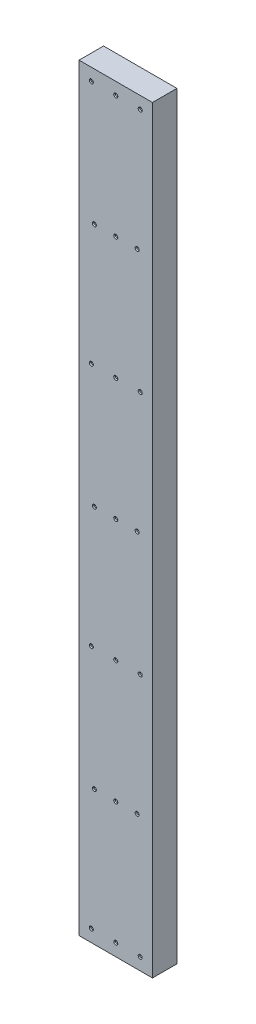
SolidWorks part; units mm, degrees
ref_plane "Front Plane" through (0, 0, 0) normal (0, 0, 1) x (1, 0, 0)
ref_plane "Top Plane" through (0, 0, 0) normal (0, 1, 0) x (1, 0, 0)
ref_plane "Right Plane" through (0, 0, 0) normal (1, 0, 0) x (0, 0, -1)
sketch "Sketch1" plane through (0, 0, 0) normal (0, 1, 0) x (1, 0, 0)
  line L1 (-76.2, 25.4) -> (76.2, 25.4)
  line L2 (-76.2, 25.4) -> (-76.2, -25.4)
  line L3 (-76.2, -25.4) -> (76.2, -25.4)
  line L4 (76.2, 25.4) -> (76.2, -25.4)
  line L5 (-76.2, 25.4) -> (76.2, -25.4) construction
  line L6 (-76.2, -25.4) -> (76.2, 25.4) construction
  point P0 (0, 0)
  dimension "D1" = 152.4
  dimension "D2" = 50.8
extrude "Boss-Extrude1" add sketch "Sketch1" along normal blind 1574.8
hole_wizard "CSK for #8 Flat Head Machine Screw (100)1" positions "Sketch3" profile "Sketch2" countersink size "#8" standard "ANSI Inch"
sketch "Sketch3" plane through (0, 0, 25.4) normal (0, 0, 1) x (1, 0, 0)
  line L0 (0, 0) -> (0, 1574.8) construction
  line L1 (-76.2, 0) -> (76.2, 0) construction
  line L2 (-76.2, 1574.8) -> (76.2, 1574.8) construction
  line L4 (-50.8, 0) -> (-50.8, 1574.8) construction
  line L6 (50.8, 1574.8) -> (50.8, 0) construction
  line L8 (-76.2, 25.4) -> (76.2, 25.4) construction
  line L9 (-76.2, 1574.8) -> (-76.2, 0) construction
  line L10 (76.2, 1574.8) -> (76.2, 0) construction
  line L12 (-76.2, 533.4) -> (76.2, 533.4) construction
  line L17 (-76.2, 1549.4) -> (76.2, 1549.4) construction
  point P0 (-50.8, 25.4)
  point P2 (0, 25.4)
  point P4 (50.8, 25.4)
  point P6 (-50.8, 1549.4)
  point P8 (0, 1549.4)
  point P10 (50.8, 1549.4)
  point P12 (-50.8, 1041.4)
  point P14 (0, 1041.4)
  point P16 (50.8, 1041.4)
  point P18 (-50.8, 533.4)
  point P20 (0, 533.4)
  point P22 (50.8, 533.4)
  dimension "D1" = 25.4
  dimension "D2" = 127
  dimension "D3" = 25.4
  dimension "D4" = 533.4
  dimension "D5" = 1041.4
  dimension "D6" = 1549.4
sketch "Sketch2" plane through (-50.8, 25.4, 25.4) normal (1, 0, 0) x (0, -1, 0)
  line L0 (0, 0) -> (0, 50.8)
  line L1 (0, 50.8) -> (2.2479, 50.8)
  line L2 (2.2479, 50.8) -> (2.2479, 1.6518)
  line L3 (2.2479, 1.6518) -> (4.2164, 0)
  line L5 (4.2164, 0) -> (0, 0)
  line L6 (-2.2479, 1.6518) -> (-4.2164, 0) construction
  line L11 (0, -6.35) -> (0, 107.95) construction
  dimension "Thru Hole Dia." = 4.4958
  dimension "Thru Hole Depth" = 50.8
  dimension "Near C'Sink Dia." = 8.4328
  dimension "Near C'Sink Angle" = 100
hole_wizard "CSK for #8 Flat Head Machine Screw (100)2" positions "Sketch5" profile "Sketch4" countersink size "#8" standard "ANSI Inch"
sketch "Sketch5" plane through (0, 0, 25.4) normal (0, 0, 1) x (1, 0, 0)
  line L0 (-76.2, 279.4) -> (76.2, 279.4) construction
  line L1 (-76.2, 1574.8) -> (-76.2, 0) construction
  line L2 (76.2, 1574.8) -> (76.2, 0) construction
  line L4 (-76.2, 787.4) -> (76.2, 787.4) construction
  line L6 (-76.2, 1295.4) -> (76.2, 1295.4) construction
  line L8 (-76.2, 0) -> (76.2, 0) construction
  point P0 (-44.45, 279.4)
  point P2 (0, 279.4)
  point P4 (44.45, 279.4)
  point P6 (-44.45, 787.4)
  point P8 (0, 787.4)
  point P10 (44.45, 787.4)
  point P12 (-44.45, 1295.4)
  point P14 (0, 1295.4)
  point P16 (44.45, 1295.4)
  dimension "D1" = 279.4
  dimension "D2" = 787.4
  dimension "D3" = 1295.4
sketch "Sketch4" plane through (-44.45, 279.4, 25.4) normal (1, 0, 0) x (0, -1, 0)
  line L0 (0, 0) -> (0, 50.8)
  line L1 (0, 50.8) -> (2.2479, 50.8)
  line L2 (2.2479, 50.8) -> (2.2479, 1.6518)
  line L3 (2.2479, 1.6518) -> (4.2164, 0)
  line L5 (4.2164, 0) -> (0, 0)
  line L6 (-2.2479, 1.6518) -> (-4.2164, 0) construction
  line L11 (0, -6.35) -> (0, 107.95) construction
  dimension "Thru Hole Dia." = 4.4958
  dimension "Thru Hole Depth" = 50.8
  dimension "Near C'Sink Dia." = 8.4328
  dimension "Near C'Sink Angle" = 100
